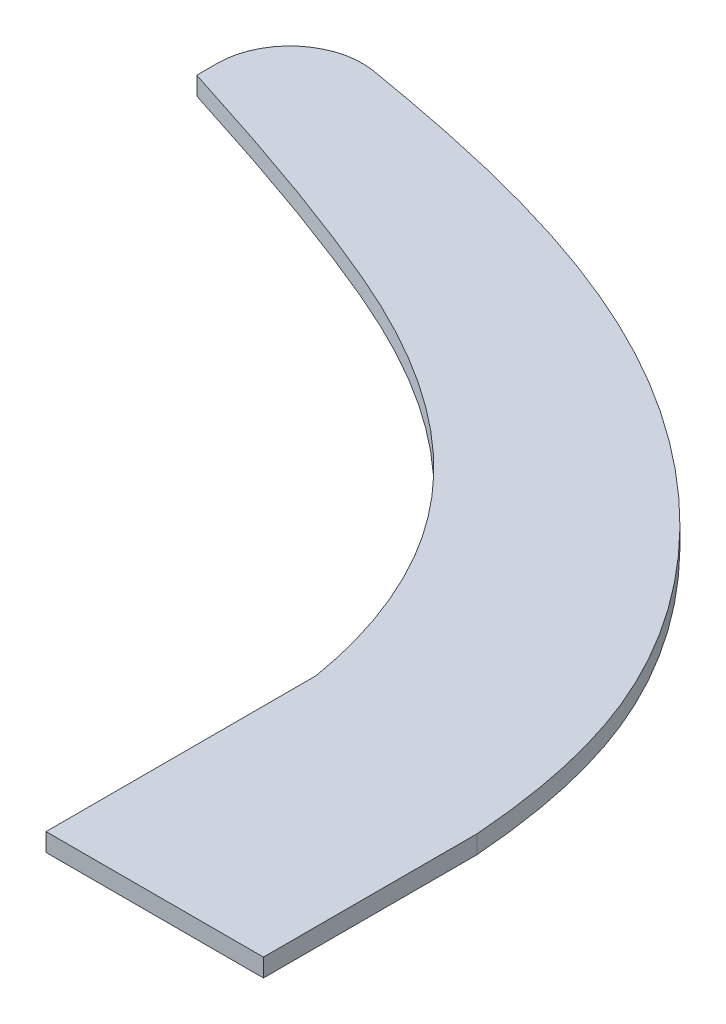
SolidWorks part; units mm, degrees
ref_plane "Front" through (0, 0, 0) normal (0, 0, 1) x (1, 0, 0)
ref_plane "Top" through (0, 0, 0) normal (0, 1, 0) x (1, 0, 0)
ref_plane "Right" through (0, 0, 0) normal (1, 0, 0) x (0, 0, -1)
sketch "Sketch1" plane through (0, 0, 0) normal (0, 1, 0) x (1, 0, 0)
  line L0 (3.3198, 48.26) -> (-72.8802, 48.26)
  line L1 (-72.8802, 48.26) -> (-72.8802, 142.9772)
  line L2 (3.3198, 48.26) -> (3.3198, 123.1825)
  line L5 (-276.0802, 304.3043) -> (-276.0802, 311.5256)
  arc A0 (-246.4526, 336.5714) -> (-276.0802, 311.5256) centre (-250.6802, 311.5256) ccw
  spline S2 degree 3 poles (3.3198, 123.1825) (1.73, 144.3509) (-10.6377, 212.5584) (-101.3084, 305.3992) (-196.449, 328.131) (-246.4526, 336.5714) knots 0.156421 0.156421 0.156421 0.156421 0.291932 0.595968 0.916312 0.916312 0.916312 0.916312
  spline S3 degree 3 poles (-72.8802, 142.9772) (-75.0895, 155.9848) (-80.1625, 174.0448) (-106.2174, 225.4242) (-147.7777, 255.8728) (-215.3131, 284.4979) (-249.397, 295.8167) (-276.0802, 304.3043) knots 0.204925 0.204925 0.204925 0.204925 0.291045 0.329597 0.561462 0.611079 0.796788 0.796788 0.796788 0.796788
  dimension "D1" = 279.4
  dimension "D2" = 25.4
  dimension "D4" = 76.2
extrude "Extrude1" add sketch "Sketch1" along normal blind 6.35
